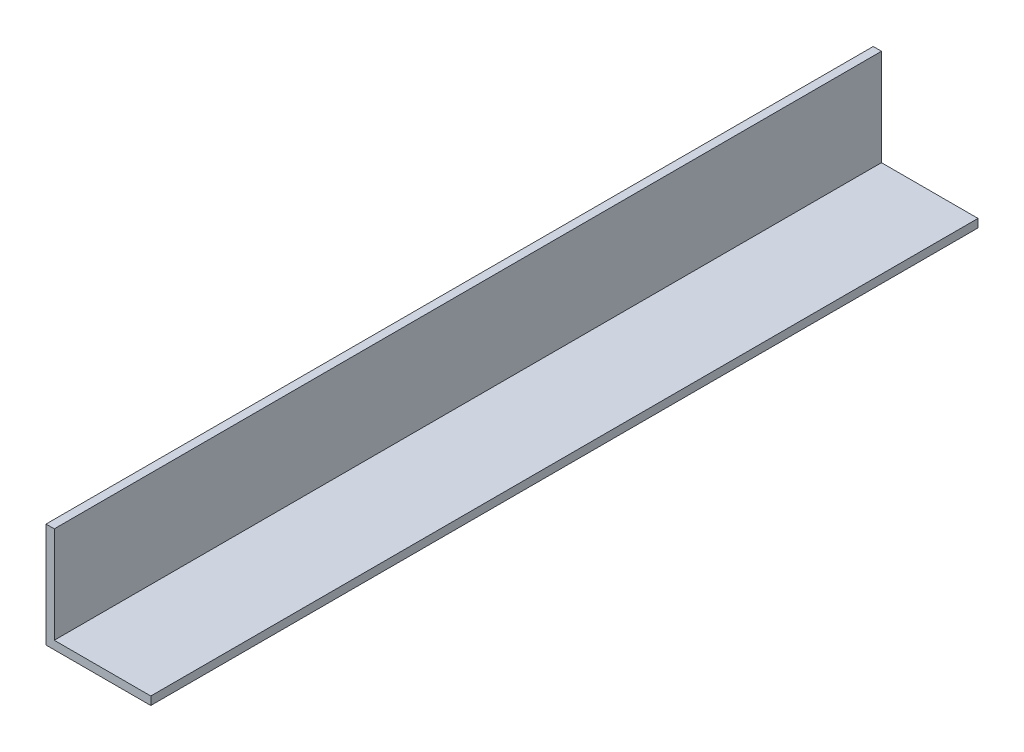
SolidWorks part; units mm, degrees
ref_plane "前视基准面" through (0, 0, 0) normal (0, 0, 1) x (1, 0, 0)
ref_plane "上视基准面" through (0, 0, 0) normal (0, 1, 0) x (1, 0, 0)
ref_plane "右视基准面" through (0, 0, 0) normal (1, 0, 0) x (0, 0, -1)
sketch "草图1" plane through (0, 0, 0) normal (0, 0, 1) x (1, 0, 0)
  line L0 (0, 0) -> (0, 38)
  line L1 (0, 38) -> (3, 38)
  line L2 (3, 38) -> (3, 3)
  line L3 (3, 3) -> (38, 3)
  line L4 (38, 3) -> (38, 0)
  line L5 (38, 0) -> (0, 0)
extrude "凸台-拉伸1" add sketch "草图1" along normal mid plane 300
